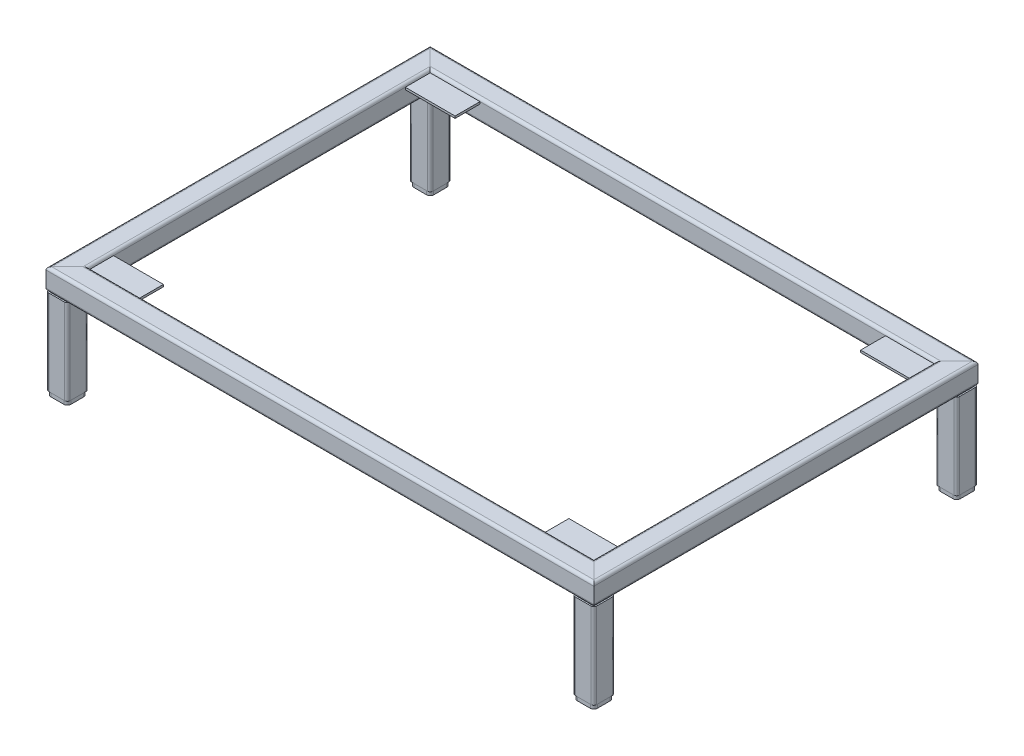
SolidWorks part; units mm, degrees
ref_plane "Plan de face" through (0, 0, 0) normal (0, 0, 1) x (1, 0, 0)
ref_plane "Plan de dessus" through (0, 0, 0) normal (0, 1, 0) x (1, 0, 0)
ref_plane "Plan de droite" through (0, 0, 0) normal (1, 0, 0) x (0, 0, -1)
sketch3d "Esquisse3D1"
  line L0 (0, 0, 0) -> (0, 0, -510)
  line L1 (0, 0, -510) -> (740, 0, -510)
  line L2 (740, 0, -510) -> (740, 0, 0)
  line L3 (740, 0, 0) -> (0, 0, 0)
  line L4 (0, 0, 0) -> (0, -135, 0)
  line L5 (0, 0, -510) -> (0, -135, -510)
  line L6 (740, 0, -510) -> (740, -135, -510)
  line L7 (740, 0, 0) -> (740, -135, 0)
  dimension "D1" = 510
  dimension "D2" = 510
  dimension "D3" = 740
  dimension "D4" = 135
  dimension "D5" = 135
  dimension "D6" = 135
  dimension "D7" = 135
other "Elément mécano-soudé1"
ref_plane "Plan1" through (0, 0, -510) normal (1, 0, 0) x (0, 0, -1)
sketch "Sketch1" plane through (0, 0, -510) normal (1, 0, 0) x (0, 0, -1)
  line L0 (-11, -13) -> (11, -13)
  line L1 (-13, -11) -> (-13, 11)
  line L2 (11, 13) -> (-11, 13)
  line L3 (13, 11) -> (13, -11)
  line L4 (-11, -15) -> (11, -15)
  line L5 (-15, -11) -> (-15, 11)
  line L6 (11, 15) -> (-11, 15)
  line L7 (15, 11) -> (15, -11)
  line L8 (-15, 0) -> (-13, 0) construction
  line L9 (-13, 0) -> (13, 0) construction
  line L10 (13, 0) -> (15, 0) construction
  line L12 (0, 15) -> (0, 13) construction
  line L13 (0, 13) -> (0, -13) construction
  line L14 (0, -13) -> (0, -15) construction
  arc A0 (15, 11) -> (11, 15) centre (11, 11) ccw
  arc A1 (11, -15) -> (15, -11) centre (11, -11) ccw
  arc A2 (-15, -11) -> (-11, -15) centre (-11, -11) ccw
  arc A3 (-11, 15) -> (-15, 11) centre (-11, 11) ccw
  arc A4 (-11, 13) -> (-13, 11) centre (-11, 11) ccw
  arc A5 (13, 11) -> (11, 13) centre (11, 11) ccw
  arc A6 (11, -13) -> (13, -11) centre (11, -11) ccw
  arc A7 (-13, -11) -> (-11, -13) centre (-11, -11) ccw
  point P2 (-15, 15)
  point P33 (-15, -15)
  point P34 (15, -15)
  point P36 (15, 15)
  point P37 (0, 0)
  dimension "D1" = 4
  dimension "Thickness" = 2
  dimension "V_leg" = 30
  dimension "H_leg" = 30
other "Embout1" parameters "D1"=6, "D2"=3, "D3"=3
fillet "Congé1" radius 5 4 edges at (14, -138, -524) (-14, -138, -524) (-14, -138, -496) (14, -138, -496)
fillet "Congé2" radius 5 4 edges at (14, -138, -14) (-14, -138, -14) (-14, -138, 14) (14, -138, 14)
fillet "Congé3" radius 5 4 edges at (754, -138, -14) (726, -138, -14) (726, -138, 14) (754, -138, 14)
fillet "Congé4" radius 5 4 edges at (754, -138, -524) (726, -138, -524) (726, -138, -496) (754, -138, -496)
sketch "Esquisse1" plane through (725, 0, 0) normal (-1, 0, 0) x (0, 0, 1)
  line L1 (-15, 11) -> (-50, 11)
  line L2 (-15, 11) -> (-15, 8)
  line L3 (-15, 8) -> (-50, 8)
  line L4 (-50, 11) -> (-50, 8)
  dimension "D1" = 3
  dimension "D2" = 35
extrude "Extrusion1" add sketch "Esquisse1" along normal blind 70 separate body
sketch "Esquisse2" plane through (15, 0, 0) normal (1, 0, 0) x (0, 0, -1)
  line L1 (15, 11) -> (50, 11)
  line L2 (15, 11) -> (15, 8)
  line L3 (15, 8) -> (50, 8)
  line L4 (50, 11) -> (50, 8)
  dimension "D1" = 3
  dimension "D2" = 35
extrude "Extrusion2" add sketch "Esquisse2" along normal blind 70 separate body
sketch "Esquisse3" [suppressed] plane through (0, 9.8, 0) normal (0, 1, 0) x (-1, 0, 0)
  line L0 (-15, -50) -> (-15, -15) construction
  line L1 (-85, -15) -> (-15, -15) construction
  line L2 (-725, -15) -> (-725, -495) construction
  line L3 (-655, -15) -> (-725, -15) construction
  point P0 (-66, -35.5)
  point P5 (-674, -35.5)
  dimension "D1" = 51
  dimension "D2" = 20.5
  dimension "D3" = 51
  dimension "D4" = 20.5
hole_wizard "Dégagement M101" positions "Esquisse3D2" profile "Esquisse4" hole size "M10" standard "ISO"
sketch3d "Esquisse3D2" [suppressed]
  point P0 (66, 9.8, -35.5)
  point P3 (674, 9.8, -35.5)
sketch "Esquisse4" plane through (66, 9.8, -35.5) normal (1, 0, 0) x (0, 0, 1)
  line L0 (0, 0) -> (0, 53.3047)
  line L1 (0, 53.3047) -> (5.5, 50)
  line L2 (5.5, 50) -> (5.5, 0)
  line L5 (5.5, 0) -> (0, 0)
  line L10 (0, 53.3047) -> (-5.5, 50) construction
  line L11 (0, -6.35) -> (0, 107.95) construction
  dimension "Diamètre du perçage" = 11
  dimension "Profondeur du perçage" = 50
  dimension "Angle de pointe" = 118
sketch "Esquisse5" plane through (725, 0, 0) normal (-1, 0, 0) x (0, 0, 1)
  line L1 (-495, 11) -> (-460, 11)
  line L2 (-495, 11) -> (-495, 8)
  line L3 (-495, 8) -> (-460, 8)
  line L4 (-460, 11) -> (-460, 8)
  dimension "D1" = 3
  dimension "D2" = 35
extrude "Extrusion3" add sketch "Esquisse5" along normal blind 70 separate body
sketch "Esquisse6" plane through (15, 0, 0) normal (1, 0, 0) x (0, 0, -1)
  line L1 (495, 11) -> (460, 11)
  line L2 (495, 11) -> (495, 8)
  line L3 (495, 8) -> (460, 8)
  line L4 (460, 11) -> (460, 8)
  dimension "D1" = 3
  dimension "D2" = 35
extrude "Extrusion4" add sketch "Esquisse6" along normal blind 70 separate body
sketch "Esquisse7" [suppressed] plane through (0, 9.8, 0) normal (0, 1, 0) x (-1, 0, 0)
  line L0 (-15, -495) -> (-15, -460) construction
  line L3 (-725, -460) -> (-725, -495) construction
  line L4 (-725, -495) -> (-15, -495) construction
  point P0 (-66, -474.5)
  point P1 (-674, -474.5)
  dimension "D1" = 51
  dimension "D2" = 51
  dimension "D3" = 20.5
  dimension "D4" = 20.5
hole_wizard "Dégagement M102" positions "Esquisse3D3" profile "Esquisse8" hole size "M10" standard "ISO"
sketch3d "Esquisse3D3" [suppressed]
  point P0 (66, 9.8, -474.5)
  point P3 (674, 9.8, -474.5)
sketch "Esquisse8" plane through (66, 9.8, -474.5) normal (1, 0, 0) x (0, 0, 1)
  line L0 (0, 0) -> (0, 53.3047)
  line L1 (0, 53.3047) -> (5.5, 50)
  line L2 (5.5, 50) -> (5.5, 0)
  line L5 (5.5, 0) -> (0, 0)
  line L10 (0, 53.3047) -> (-5.5, 50) construction
  line L11 (0, -6.35) -> (0, 107.95) construction
  dimension "Diamètre du perçage" = 11
  dimension "Profondeur du perçage" = 50
  dimension "Angle de pointe" = 118
sketch "Esquisse12" plane through (0, -141, 0) normal (0, -1, 0) x (1, 0, 0)
  line L0 (-14, 9) -> (-14, -9) construction
  line L1 (-9, -14) -> (9, -14) construction
  line L2 (-9, -524) -> (9, -524) construction
  line L3 (754, -519) -> (754, -501) construction
  line L4 (726, 9) -> (726, -9) construction
  point P1 (-0.3, -0.3)
  point P6 (0, -510.3)
  point P9 (740.3, -510)
  point P12 (739.7, 0)
  dimension "D1" = 13.7
  dimension "D2" = 13.7
  dimension "D3" = 13.7
  dimension "D4" = 13.7
  dimension "D5" = 13.7
sketch "Esquisse13" plane through (0, -141, 0) normal (0, -1, 0) x (1, 0, 0)
  circle A0 centre (0, 0) radius 6.25
  circle A1 centre (0, -510.3) radius 5.4
  circle A2 centre (740.3, -510) radius 5.4
  circle A3 centre (739.7, 0) radius 5.4
  dimension "D1" = 10.8
  dimension "D2" = 12.5
  dimension "D3" = 10.8
  dimension "D4" = 10.8
extrude "Extrusion5" cut sketch "Esquisse13" against normal blind 10
